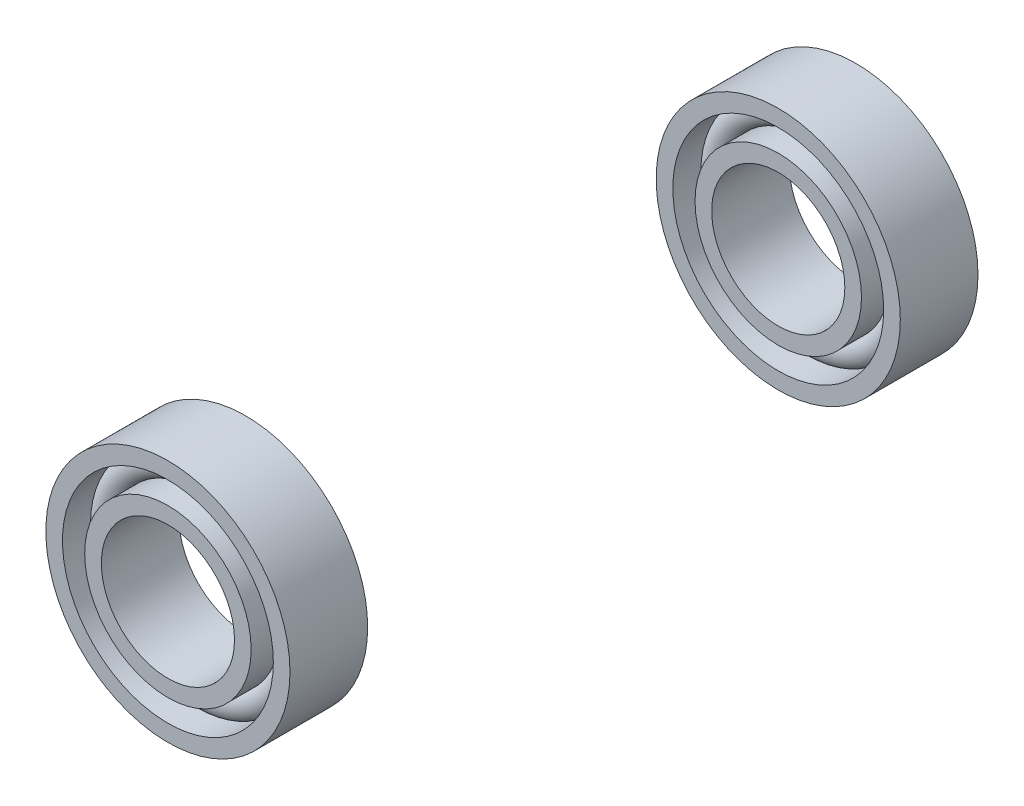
SolidWorks part; units mm, degrees
ref_plane "Alzado" through (0, 0, 0) normal (0, 0, 1) x (1, 0, 0)
ref_plane "Planta" through (0, 0, 0) normal (0, 1, 0) x (1, 0, 0)
ref_plane "Vista lateral" through (0, 0, 0) normal (1, 0, 0) x (0, 0, -1)
sketch "Sk_Pista_int_1" plane through (0, 0, 0) normal (0, 1, 0) x (1, 0, 0)
  line L0 (-178.5, 84.5) -> (-180, 84.5)
  line L1 (-180, 84.5) -> (-180, 91.5)
  line L2 (-180, 91.5) -> (-178.5, 91.5)
  line L3 (-178.5, 91.5) -> (-178.5, 84.5)
  line L4 (-172.5, 79.5) -> (-172.5, 96.5) construction
revolve "Pista_int_1" add sketch "Sk_Pista_int_1" angle 360 about L4
sketch "Sk_Pista_ext_1" plane through (0, 0, 0) normal (0, 1, 0) x (1, 0, 0)
  line L0 (-182, 84.5) -> (-183.5, 84.5)
  line L1 (-183.5, 84.5) -> (-183.5, 91.5)
  line L2 (-183.5, 91.5) -> (-182, 91.5)
  line L3 (-182, 91.5) -> (-182, 84.5)
  line L4 (-172.5, 79.5) -> (-172.5, 96.5) construction
revolve "Pista_ext_1" add sketch "Sk_Pista_ext_1" angle 360 about L4
sketch "Sk_Bolas_1" plane through (0, 0, 0) normal (0, 1, 0) x (1, 0, 0)
  line L0 (-172.5, 83) -> (-172.5, 93) construction
  circle A0 centre (-181, 88) radius 1.4
  dimension "DIAM1" = 2.8
revolve "Bolas_1" add sketch "Sk_Bolas_1" angle 360 about L0
sketch "Sk_Pista_int_2" plane through (0, 0, 0) normal (0, 1, 0) x (1, 0, 0)
  line L0 (-178.5, 139.5) -> (-180, 139.5)
  line L1 (-180, 139.5) -> (-180, 146.5)
  line L2 (-180, 146.5) -> (-178.5, 146.5)
  line L3 (-178.5, 146.5) -> (-178.5, 139.5)
  line L4 (-172.5, 134.5) -> (-172.5, 151.5) construction
revolve "Pista_int_2" add sketch "Sk_Pista_int_2" angle 360 about L4
sketch "Sk_Pista_ext_2" plane through (0, 0, 0) normal (0, 1, 0) x (1, 0, 0)
  line L0 (-182, 139.5) -> (-183.5, 139.5)
  line L1 (-183.5, 139.5) -> (-183.5, 146.5)
  line L2 (-183.5, 146.5) -> (-182, 146.5)
  line L3 (-182, 146.5) -> (-182, 139.5)
  line L4 (-172.5, 134.5) -> (-172.5, 151.5) construction
revolve "Pista_ext_2" add sketch "Sk_Pista_ext_2" angle 360 about L4
sketch "Sk_Bolas_2" plane through (0, 0, 0) normal (0, 1, 0) x (1, 0, 0)
  line L0 (-172.5, 138) -> (-172.5, 148) construction
  circle A0 centre (-181, 143) radius 1.4
  dimension "DIAM2" = 2.8
revolve "Bolas_2" add sketch "Sk_Bolas_2" angle 360 about L0
